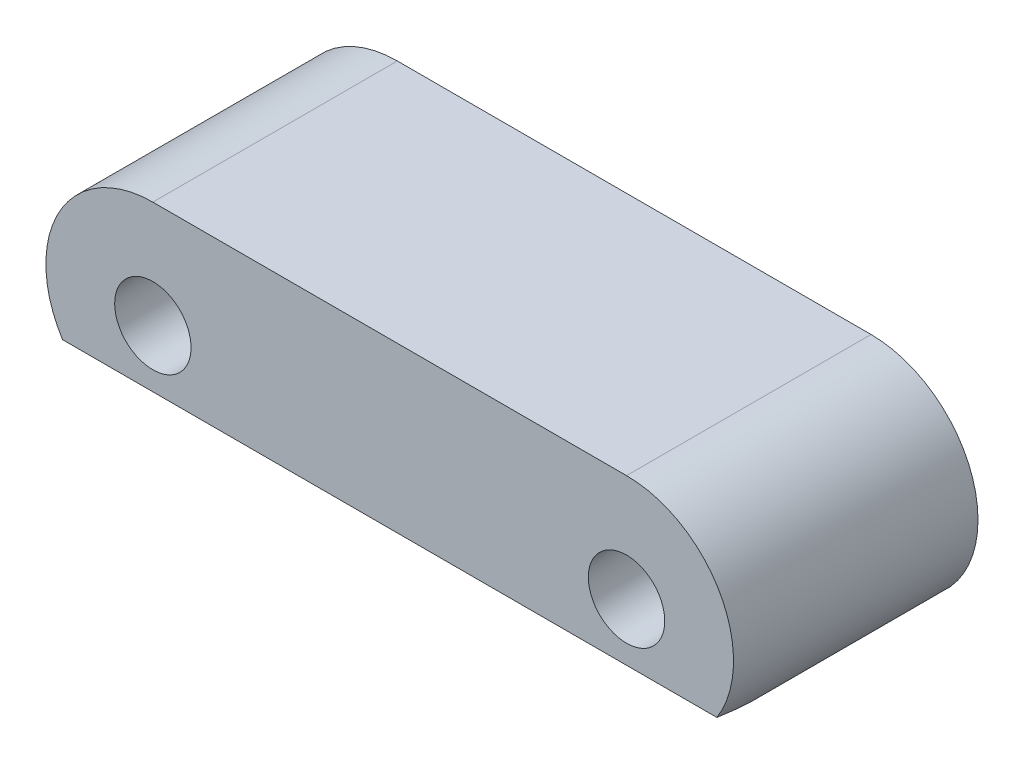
SolidWorks part; units mm, degrees
ref_plane "Face" through (0, 0, 0) normal (0, 0, 1) x (1, 0, 0)
ref_plane "Dessus" through (0, 0, 0) normal (0, 1, 0) x (1, 0, 0)
ref_plane "Droite" through (0, 0, 0) normal (1, 0, 0) x (0, 0, -1)
sketch "Esquisse1" plane through (0, 0, 0) normal (0, 0, 1) x (1, 0, 0)
  line L0 (0, 7) -> (31, 7)
  line L1 (0, -7) -> (31, -7)
  arc A0 (0, 7) -> (0, -7) centre (0, 0) ccw
  arc A1 (31, -7) -> (31, 7) centre (31, 0) ccw
  dimension "D2" = 7
  dimension "D1" = 31
extrude "Extrusion1" add sketch "Esquisse1" along normal blind 16
sketch "Esquisse2" plane through (0, 0, 0) normal (1, 0, 0) x (0, 0, -1)
  line L0 (-6, -7) -> (-16, -3.7508)
  line L3 (-16, -7) -> (0, -7) construction
  line L4 (-16, 7) -> (-16, -7) construction
  line L6 (-16, -3.7508) -> (-16, -7)
  line L7 (-16, -7) -> (-6, -7)
  line L8 (0, -7) -> (0, 7) construction
  dimension "D1" = 6
  dimension "D2" = 18
extrude "Enlèv. mat.-Extru.1" cut sketch "Esquisse2" against normal through all and the other way through all
hole_wizard "Trou taraudé M6x1.01" positions "Esquisse4" profile "Esquisse3" tap size "M6x1.0" standard "Ansi Métrique"
sketch "Esquisse4" plane through (0, 0, 0) normal (0, 0, -1) x (-1, 0, 0)
  point P0 (-31, 0)
  point P1 (0, 0)
sketch "Esquisse3" plane through (31, 0, 0) normal (1, 0, 0) x (0, 1, 0)
  line L0 (0, 0) -> (0, 16)
  line L1 (0, 16) -> (2.5, 16)
  line L2 (2.5, 16) -> (2.5, 0)
  line L5 (2.5, 0) -> (0, 0)
  line L11 (0, -6.35) -> (0, 107.95) construction
  dimension "Diamètre du trou pour taraudage jusqu'au prochain" = 5
  dimension "Profondeur du trou pour taraudage jusqu'au prochain" = 16
